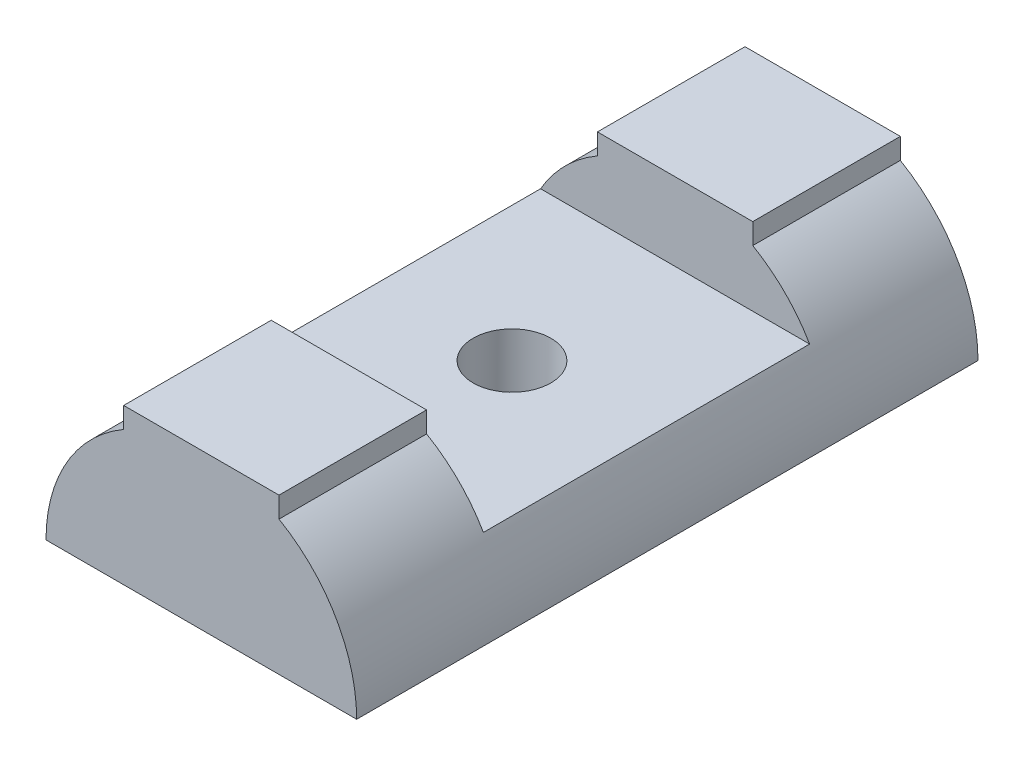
SolidWorks part; units mm, degrees
ref_plane "Front Plane" through (0, 0, 0) normal (0, 0, 1) x (1, 0, 0)
ref_plane "Top Plane" through (0, 0, 0) normal (0, 1, 0) x (1, 0, 0)
ref_plane "Right Plane" through (0, 0, 0) normal (1, 0, 0) x (0, 0, -1)
sketch "Sketch1" plane through (0, 0, 0) normal (0, 0, 1) x (1, 0, 0)
  circle A0 centre (0, 0) radius 10
  dimension "D1" = 20
extrude "Boss-Extrude1" add sketch "Sketch1" along normal mid plane 40
sketch "Sketch2" plane through (0, 0, 20) normal (0, 0, 1) x (1, 0, 0)
  line L1 (5, -10) -> (-5, -10)
  line L2 (5, -10) -> (5, 10)
  line L3 (5, 10) -> (-5, 10)
  line L4 (-5, -10) -> (-5, 10)
  line L5 (5, -10) -> (-5, 10) construction
  line L6 (5, 10) -> (-5, -10) construction
  circle A0 centre (0, 0) radius 10 construction
  point P0 (0, 0)
  dimension "D2" = 10
extrude "Boss-Extrude2" add sketch "Sketch2" against normal up to surface (40 mm away)
sketch "Sketch3" plane through (0, 0, 0) normal (0, 0, 1) x (1, 0, 0)
  line L1 (8.6603, 5) -> (-8.6603, 5)
  line L2 (8.6603, 5) -> (8.6603, 10)
  line L3 (8.6603, 10) -> (-8.6603, 10)
  line L4 (-8.6603, 5) -> (-8.6603, 10)
  line L5 (8.6603, 5) -> (-8.6603, 10) construction
  line L6 (8.6603, 10) -> (-8.6603, 5) construction
  circle A0 centre (0, 0) radius 10 construction
  point P0 (0, 7.5)
  dimension "D1" = 5
extrude "Cut-Extrude1" cut sketch "Sketch3" against normal mid plane 21
sketch "Sketch4" plane through (0, 5, 0) normal (0, 1, 0) x (1, 0, 0)
  circle A0 centre (0, 0) radius 2.5
  dimension "D1" = 5
extrude "Cut-Extrude2" cut sketch "Sketch4" against normal through all
sketch "Sketch5" plane through (0, 0, 20) normal (0, 0, 1) x (1, 0, 0)
  line L0 (-5, -10) -> (5, -10) construction
  line L1 (10, -10) -> (-10, -10)
  line L2 (10, -10) -> (10, 0)
  line L3 (10, 0) -> (-10, 0)
  line L4 (-10, -10) -> (-10, 0)
  line L5 (10, -10) -> (-10, 0) construction
  line L6 (10, 0) -> (-10, -10) construction
  arc A0 (-5, 8.6603) -> (-5, -8.6603) centre (0, 0) ccw construction
  point P0 (0, -5)
extrude "Cut-Extrude3" cut sketch "Sketch5" against normal through all
